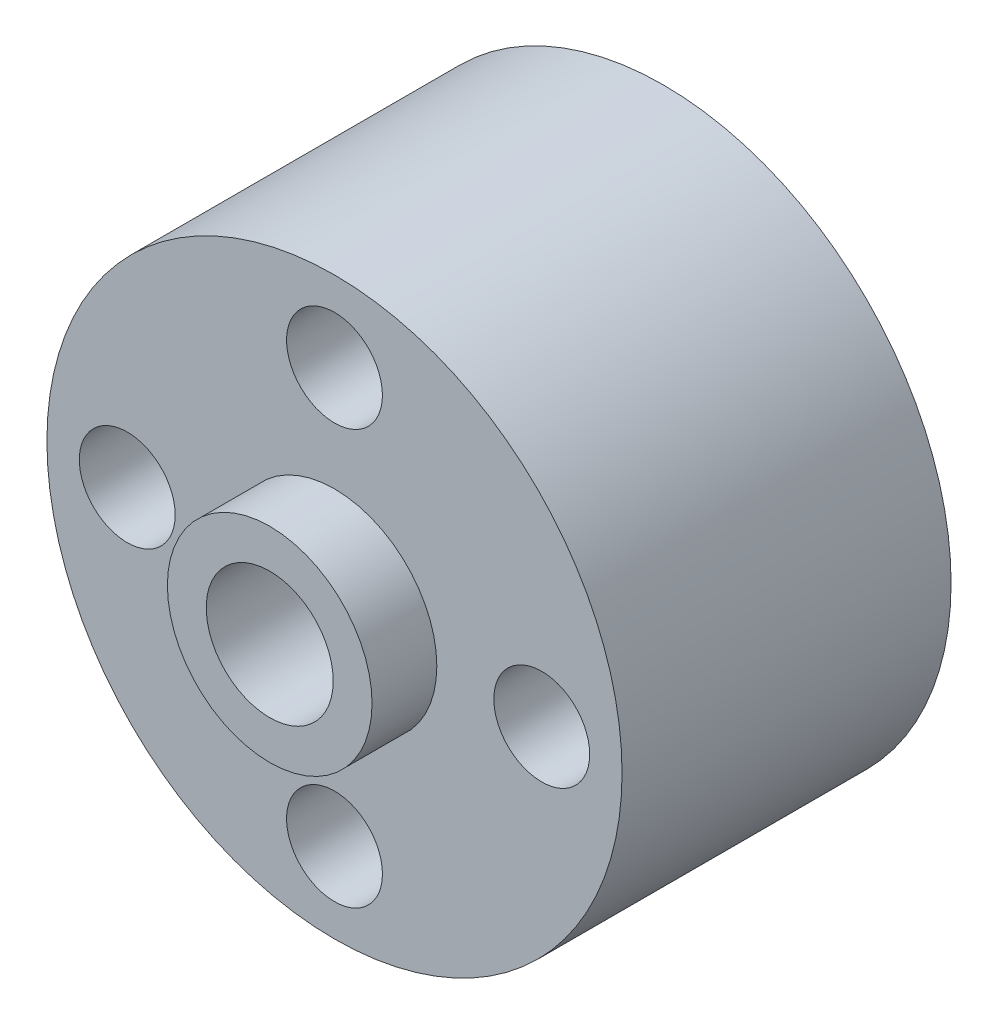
SolidWorks part; units mm, degrees
ref_plane "Front Plane" through (0, 0, 0) normal (0, 0, 1) x (1, 0, 0)
ref_plane "Top Plane" through (0, 0, 0) normal (0, 1, 0) x (1, 0, 0)
ref_plane "Right Plane" through (0, 0, 0) normal (1, 0, 0) x (0, 0, -1)
sketch "Sketch1" plane through (0, 0, 0) normal (0, 0, 1) x (1, 0, 0)
  circle A0 centre (0, 0) radius 11.1
  dimension "D1" = 22.2
extrude "Extrude1" add sketch "Sketch1" against normal blind 12.7
sketch "Sketch3" plane through (0, 0, 0) normal (0, 0, 1) x (1, 0, 0)
  circle A1 centre (8, 0) radius 1.85
  circle A2 centre (-8, 0) radius 1.85
  circle A3 centre (0, -8) radius 1.85
  circle A4 centre (0, 8) radius 1.85
extrude "Cut-Extrude1" cut sketch "Sketch3" against normal through all
sketch "Sketch6" plane through (0, 0, 0) normal (0, 0, 1) x (1, 0, 0)
  circle A0 centre (0, 0) radius 3.95
  dimension "D1" = 7.9
extrude "Extrude3" add sketch "Sketch6" along normal blind 2.5
sketch "Sketch7" plane through (0, 0, -12.7) normal (0, 0, -1) x (-1, 0, 0)
  circle A0 centre (0, 0) radius 3.95
  dimension "D1" = 7.9
extrude "Extrude4" add sketch "Sketch7" along normal blind 2.5
sketch "Sketch8" plane through (0, 0, 2.5) normal (0, 0, 1) x (1, 0, 0)
  circle A0 centre (0, 0) radius 2.45
  dimension "D1" = 4.9
extrude "Cut-Extrude2" cut sketch "Sketch8" against normal through all
